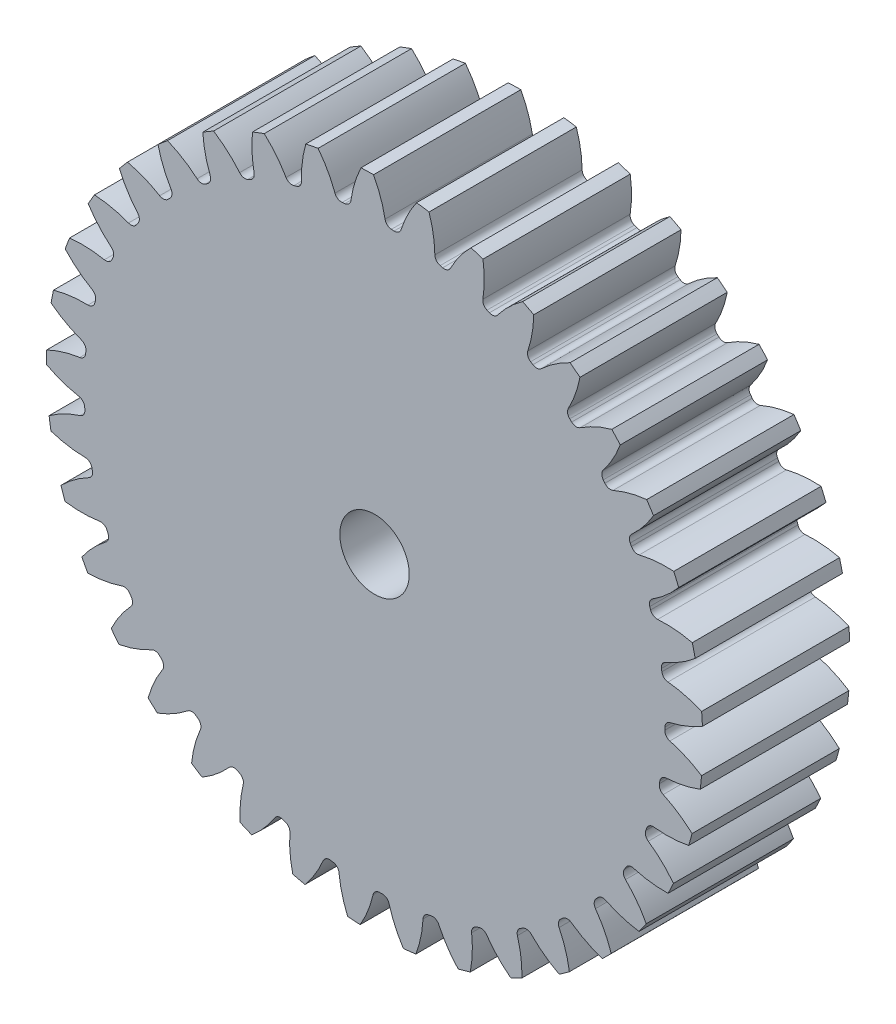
SolidWorks part; units mm, degrees
ref_plane "Front" through (0, 0, 0) normal (0, 0, 1) x (1, 0, 0)
ref_plane "Top" through (0, 0, 0) normal (0, 1, 0) x (1, 0, 0)
ref_plane "Right" through (0, 0, 0) normal (1, 0, 0) x (0, 0, -1)
sketch "Sketch3" plane through (0, 0, 0) normal (0, 0, 1) x (1, 0, 0)
  circle A0 centre (0, 0) radius 198.12
  dimension "od" = 396.24
extrude "gearBody" add sketch "Sketch3" along normal blind 88.9
sketch "Sketch2" plane through (0, 0, 0) normal (0, 0, 1) x (1, 0, 0)
  line L0 (0, 0) -> (163.1799, 67.5913) construction
  line L1 (197.5851, -17.1715) -> (0, 0) construction
  line L2 (0, 0) -> (36.3143, 0) construction
  line L3 (187.9147, 4.1277) -> (187.5914, -11.7661) construction
  line L5 (187.753, -3.8192) -> (0, 0) construction
  line L7 (0, 0) -> (176.6246, 0) construction
  arc A0 (176.6227, 0.8175) -> (176.4434, -7.9995) centre (0, 0) ccw construction
  arc A1 (197.9155, 9.0005) -> (197.3857, -17.0416) centre (0, 0) ccw construction
  arc A2 (187.9147, 4.1277) -> (187.5914, -11.7661) centre (0, 0) ccw construction
  arc A3 (175.2054, -4.3744) -> (175.2384, -2.7542) centre (0, 0) ccw
  arc A4 (197.5851, -17.1715) -> (178.2493, -8.4665) centre (160.2962, -74.1714) ccw
  arc A5 (197.5851, -17.1715) -> (198.12, 9.1222) centre (0, 0) ccw
  arc A6 (198.12, 9.1222) -> (178.4462, 1.2107) centre (163.1799, 67.5913) cw
  arc A7 (175.2384, -2.7542) -> (178.4462, 1.2107) centre (179.373, -2.8192) cw
  arc A8 (178.2493, -8.4665) -> (175.2054, -4.3744) centre (179.3392, -4.4776) cw
  point P6 (198.12, 9.1222)
  point P22 (197.5851, -17.1715)
  dimension "baseDia" = 353.2493
  dimension "od" = 396.24
  dimension "pd" = 375.92
  dimension "rd" = 350.52
  dimension "rFillet" = 4.1351
  dimension "pointX" = 198.12
  dimension "pointY" = 9.1222
  dimension "CTT" = 15.8937
  dimension "flankCenterAngle" = 22.5
extrude "toothCut" cut sketch "Sketch2" along normal through all
pattern_circular "CirPattern1" count 37 over 360 about axis through (0, 0, 0) along (0, 0, 1) of "toothCut"
sketch "hub1Dia" plane through (0, 0, 0) normal (0, 0, -1) x (-1, 0, 0)
  circle A0 centre (0, 0) radius 12.7
  dimension "hub1Dia" = 25.4
sketch "hub2Dia" plane through (0, 0, 88.9) normal (0, 0, 1) x (1, 0, 0)
  circle A0 centre (0, 0) radius 12.7
  dimension "hub2dia" = 25.4
sketch "boreDia" plane through (0, 0, 0) normal (0, 0, 1) x (1, 0, 0)
  circle A0 centre (0, 0) radius 20.955
  dimension "boreDia" = 41.91
extrude "bore" cut sketch "boreDia" against normal mid plane 25400
